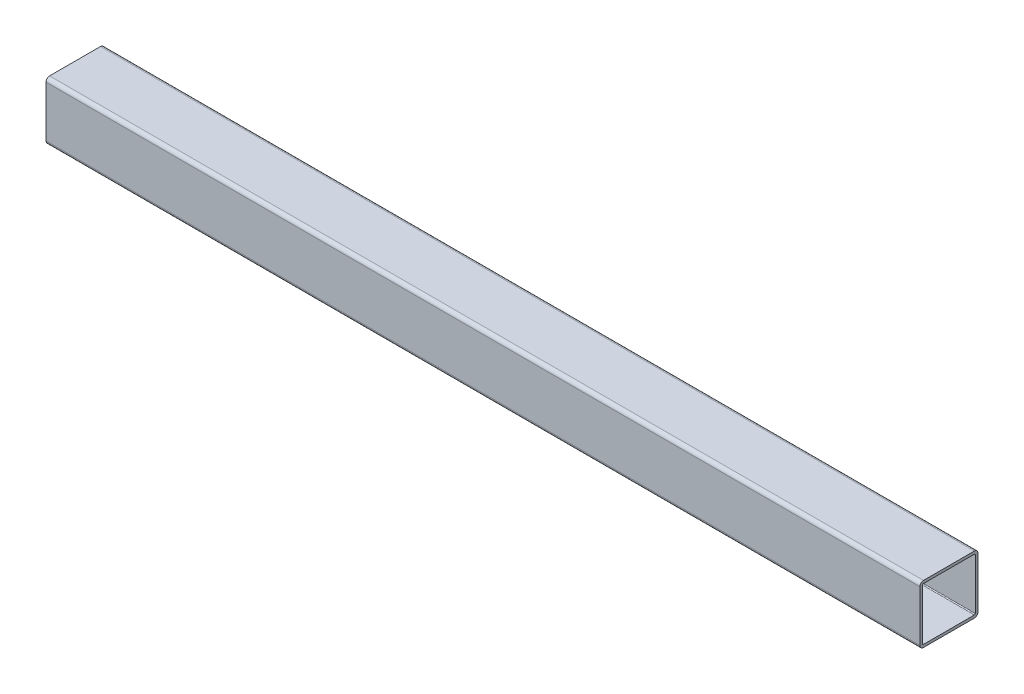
SolidWorks part; units mm, degrees
ref_plane "Front Plane" through (0, 0, 0) normal (0, 0, 1) x (1, 0, 0)
ref_plane "Top Plane" through (0, 0, 0) normal (0, 1, 0) x (1, 0, 0)
ref_plane "Right Plane" through (0, 0, 0) normal (1, 0, 0) x (0, 0, -1)
imported_body "Imported1"
sketch "Sketch1" plane through (927.1, 0, 0) normal (1, 0, 0) x (0, 0, -1)
  line L0 (44.45, 46.0375) -> (-44.45, 46.0375)
  line L1 (-46.0375, 44.45) -> (-46.0375, -44.45)
  line L2 (-44.45, -46.0375) -> (44.45, -46.0375)
  line L3 (46.0375, -44.45) -> (46.0375, 44.45)
  line L4 (50.8, -44.45) -> (50.8, 44.45)
  line L5 (44.45, 50.8) -> (-44.45, 50.8)
  line L6 (-50.8, 44.45) -> (-50.8, -44.45)
  line L7 (-44.45, -50.8) -> (44.45, -50.8)
  line L8 (50.8, -44.45) -> (50.8, 44.45)
  line L9 (44.45, 50.8) -> (-44.45, 50.8)
  line L10 (-50.8, 44.45) -> (-50.8, -44.45)
  line L11 (-44.45, -50.8) -> (44.45, -50.8)
  arc A0 (-44.45, 46.0375) -> (-46.0375, 44.45) centre (-44.45, 44.45) ccw
  arc A1 (-46.0375, -44.45) -> (-44.45, -46.0375) centre (-44.45, -44.45) ccw
  arc A2 (44.45, -46.0375) -> (46.0375, -44.45) centre (44.45, -44.45) ccw
  arc A3 (46.0375, 44.45) -> (44.45, 46.0375) centre (44.45, 44.45) ccw
  arc A4 (50.8, 44.45) -> (44.45, 50.8) centre (44.45, 44.45) ccw
  arc A5 (-44.45, 50.8) -> (-50.8, 44.45) centre (-44.45, 44.45) ccw
  arc A6 (-50.8, -44.45) -> (-44.45, -50.8) centre (-44.45, -44.45) ccw
  arc A7 (44.45, -50.8) -> (50.8, -44.45) centre (44.45, -44.45) ccw
  arc A8 (50.8, 44.45) -> (44.45, 50.8) centre (44.45, 44.45) ccw
  arc A9 (-44.45, 50.8) -> (-50.8, 44.45) centre (-44.45, 44.45) ccw
  arc A10 (-50.8, -44.45) -> (-44.45, -50.8) centre (-44.45, -44.45) ccw
  arc A11 (44.45, -50.8) -> (50.8, -44.45) centre (44.45, -44.45) ccw
  dimension "D1" = 0
  dimension "D2" = 4.7625
extrude "Extrude1" add sketch "Sketch1" along normal blind 130.048
sketch "Sketch2" plane through (0, -50.8, 0) normal (0, -1, 0) x (1, 0, 0)
  line L0 (-470.662, 50.8) -> (-470.662, -50.8)
  line L1 (1057.148, 44.45) -> (1057.148, -44.45) construction
  line L2 (-927.1, 50.8) -> (1057.148, 50.8) construction
  line L3 (-927.1, -50.8) -> (1057.148, -50.8) construction
  dimension "D1" = 1527.81
extrude "Cut-Extrude1" cut sketch "Sketch2" against normal through all and the other way through all flip side to cut
